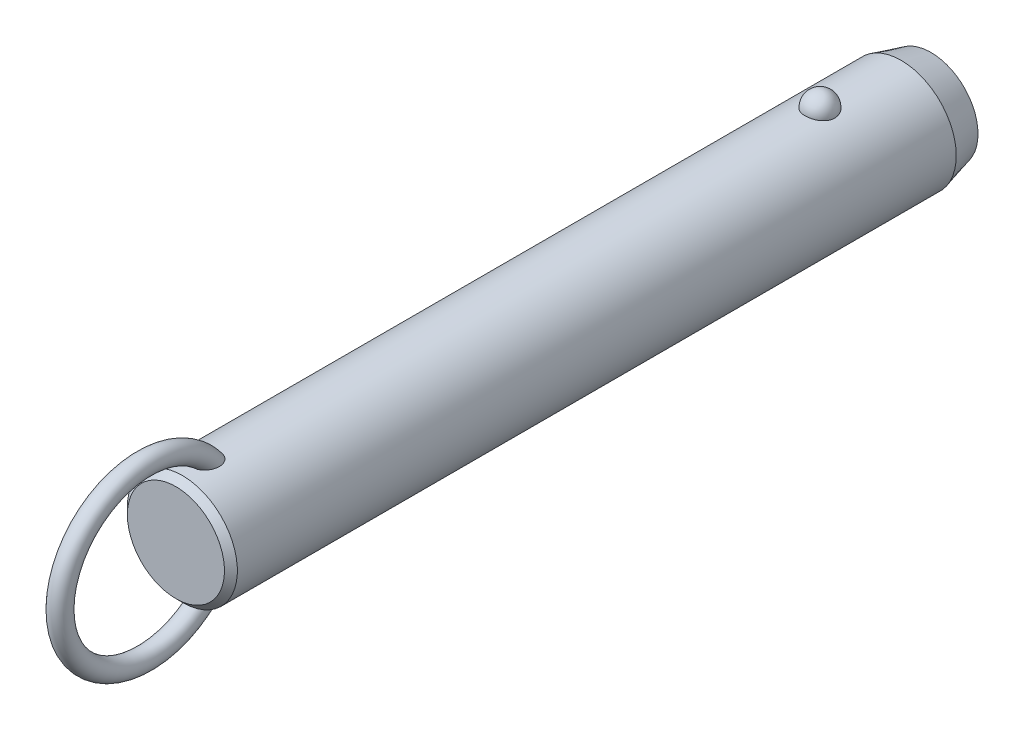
SolidWorks part; units mm, degrees
ref_plane "Front Plane" through (0, 0, 0) normal (0, 0, 1) x (1, 0, 0)
ref_plane "Top Plane" through (0, 0, 0) normal (0, 1, 0) x (1, 0, 0)
ref_plane "Right Plane" through (0, 0, 0) normal (1, 0, 0) x (0, 0, -1)
sketch "Sketch2" plane through (0, 0, 0) normal (0, 0, 1) x (1, 0, 0)
  circle A0 centre (0, 0) radius 11.1
  point P3 (0, 11.1)
  dimension "D1" = 22.2
extrude "Boss-Extrude1" add sketch "Sketch2" along normal blind 114.3
sketch "Sketch3" plane through (0, 0, 0) normal (0, 0, -1) x (-1, 0, 0)
  circle A0 centre (0, 0) radius 11.1
  dimension "D1" = 22.2
extrude "Boss-Extrude2" add sketch "Sketch3" along normal blind 25.4
chamfer "Chamfer1" distance 6 angle 15 1 edges at (-11.1, 0, -25.4)
sketch "Sketch12" plane through (0, 0, 0) normal (1, 0, 0) x (0, 0, -1)
  line L0 (-114.3, 11.1) -> (-114.3, -11.1) construction
  point P0 (-114.3, 0)
sketch "Sketch13" plane through (0, 0, 0) normal (1, 0, 0) x (0, 0, -1)
  circle A0 centre (-133.35, 0) radius 19.05
  point P2 (-114.3, 0)
  dimension "D1" = 38.1
sketch "Sketch14" plane through (0, 0, 0) normal (0, 1, 0) x (1, 0, 0)
  circle A0 centre (0, -116.3) radius 2
  point P2 (0, -114.3)
  dimension "D1" = 4
sweep "Sweep1" add profiles "Sketch14" path "Sketch13"
sketch "Sketch15" plane through (0, 0, 114.3) normal (0, 0, 1) x (1, 0, 0)
  circle A0 centre (0, 0) radius 11.1
  dimension "D1" = 22.2
extrude "Boss-Extrude3" add sketch "Sketch15" along normal blind 12.7
chamfer "Chamfer2" distance 1.3 angle 45 1 edges at (11.1, 0, 127)
sketch "Sketch18" plane through (0, 0, 0) normal (1, 0, 0) x (0, 0, -1)
  line L0 (19.4, 11.1) -> (-117.868, 11.1) construction
  line L1 (3, 14.1) -> (3, 8.1)
  line L2 (-117.868, -11.1) -> (19.4, -11.1) construction
  arc A0 (3, 14.1) -> (3, 8.1) centre (3, 11.1) ccw
  point P4 (0, 11.1)
  dimension "D1" = 25.2
revolve "Revolve1" add sketch "Sketch18" angle 360 about L1
